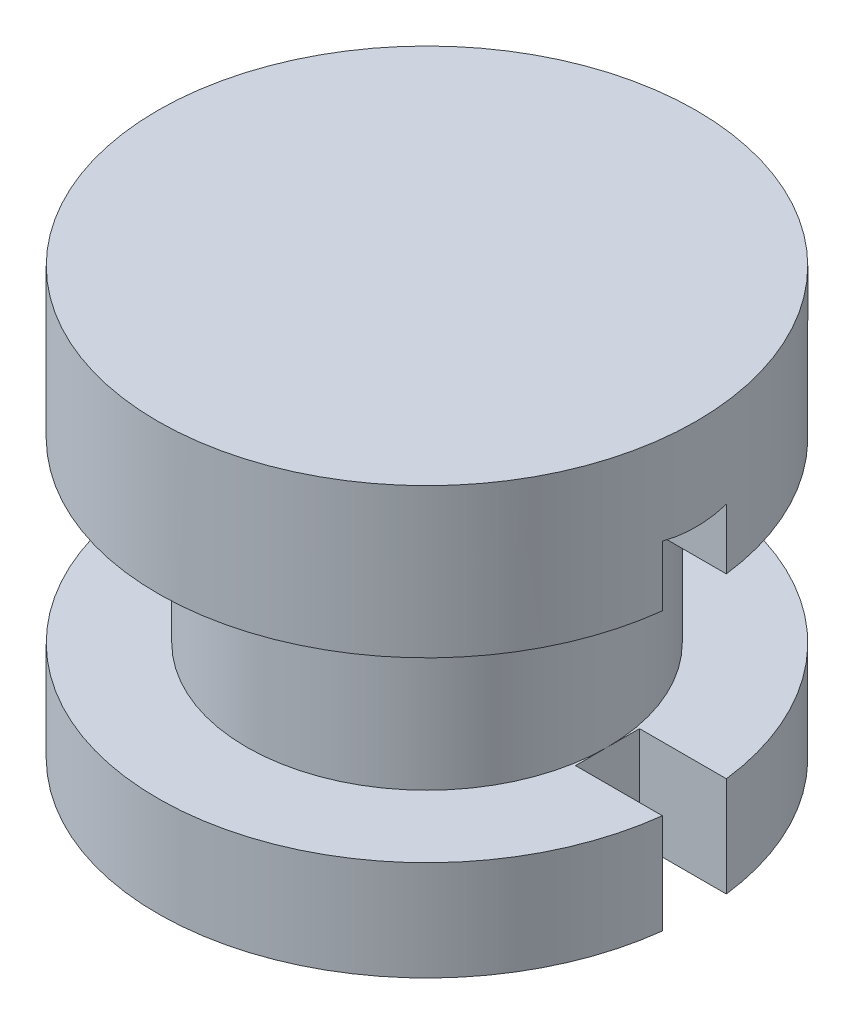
SolidWorks part; units mm, degrees
ref_plane "Ebene vorne" through (0, 0, 0) normal (0, 0, 1) x (1, 0, 0)
ref_plane "Ebene oben" through (0, 0, 0) normal (0, 1, 0) x (1, 0, 0)
ref_plane "Ebene rechts" through (0, 0, 0) normal (1, 0, 0) x (0, 0, -1)
sketch "Skizze1" plane through (0, 0, 0) normal (0, 0, 1) x (1, 0, 0)
  line L0 (0, 56.546) -> (0, 0)
  line L1 (0, 0) -> (50.6582, 0)
  line L2 (50.6582, 0) -> (10.8651, 56.546)
  line L3 (10.8651, 56.546) -> (0, 56.546)
  line L4 (-28.1826, 69.7762) -> (-28.1826, 0) construction
  line L5 (-28.1826, 66.58) -> (13.8587, 66.58)
  line L6 (13.8587, 66.58) -> (13.8587, 43.293)
  line L7 (13.8587, 43.293) -> (0, 43.293)
  line L8 (0, 43.293) -> (0, 15.5922)
  line L9 (0, 15.5922) -> (13.8587, 15.5922)
  line L10 (13.8587, 15.5922) -> (13.8587, 0)
  line L11 (13.8587, 0) -> (-29.4002, 0)
revolve "Rotation1" add sketch "Skizze1" angle 360 about L4
other "Formnest1"
other "ZEBRO 0<1>@SZPULKA Z ZEBREM1"
equation "\"LÄNGE\"=0"
equation "\"BREITE\"=0"
equation "\"HÖHE\"=0"
equation "\"DURCHMESSER\"=0"
equation "\"Stückzahl\"= 1"
